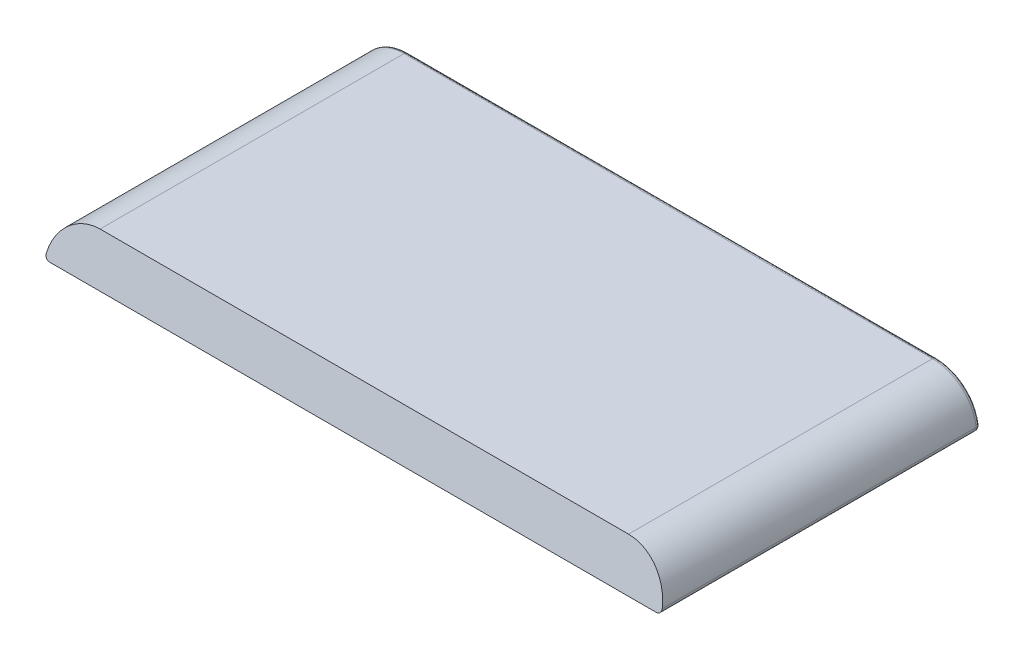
SolidWorks part; units mm, degrees
ref_plane "Front Plane" through (0, 0, 0) normal (0, 0, 1) x (1, 0, 0)
ref_plane "Top Plane" through (0, 0, 0) normal (0, 1, 0) x (1, 0, 0)
ref_plane "Right Plane" through (0, 0, 0) normal (1, 0, 0) x (0, 0, -1)
sketch "Sketch1" plane through (0, 0, 0) normal (0, 0, 1) x (1, 0, 0)
  line L0 (-300, 364.4636) -> (300, 364.4636) construction
  line L1 (-300, 364.4636) -> (300, 364.4636)
  line L2 (350, 316.1673) -> (-350, 316.1673)
  ellipse E0 centre (-300, 316.1673) end of major axis (-350, 316.1673) minor radius 48.2963 (-300, 364.4636) -> (-350, 316.1673) ccw construction
  ellipse E1 centre (300, 316.1673) end of major axis (250, 316.1673) minor radius 48.2963 (350, 316.1673) -> (300, 364.4636) ccw construction
  ellipse E2 centre (-300, 316.1673) end of major axis (-350, 316.1673) minor radius 48.2963 (-300, 364.4636) -> (-350, 316.1673) ccw
  ellipse E3 centre (300, 316.1673) end of major axis (250, 316.1673) minor radius 48.2963 (350, 316.1673) -> (300, 364.4636) ccw
extrude "Boss-Extrude1" add sketch "Sketch1" along normal up to surface (350 mm away)
fillet "Fillet1" radius 5 6 edges at (-335.3553, 350.318, 0) (0, 364.4636, 0) (0, 316.1673, 0) (335.3553, 350.318, 0) (-350, 316.1673, 181.4705) (350, 316.1673, 181.4705)
shell "Shell1" thickness 3
sketch "Sketch2" plane through (0, 316.1673, 0) normal (0, -1, 0) x (1, 0, 0)
  line L0 (0, 944.8935) -> (0, -28.8725) construction
  line L1 (243.5, 38.9705) -> (-243.5, 38.9705)
  line L2 (243.5, 38.9705) -> (243.5, 328.9705)
  line L3 (243.5, 328.9705) -> (-243.5, 328.9705)
  line L4 (-243.5, 38.9705) -> (-243.5, 328.9705)
  line L5 (243.5, 38.9705) -> (-243.5, 328.9705) construction
  line L6 (243.5, 328.9705) -> (-243.5, 38.9705) construction
  line L7 (-344.6989, 362.941) -> (-344.6989, 5) construction
  point P0 (0, 183.9705)
  point P9 (-344.6989, 183.9705)
  dimension "D1" = 290
  dimension "D2" = 487
extrude "Cut-Extrude1" cut sketch "Sketch2" against normal up to next
